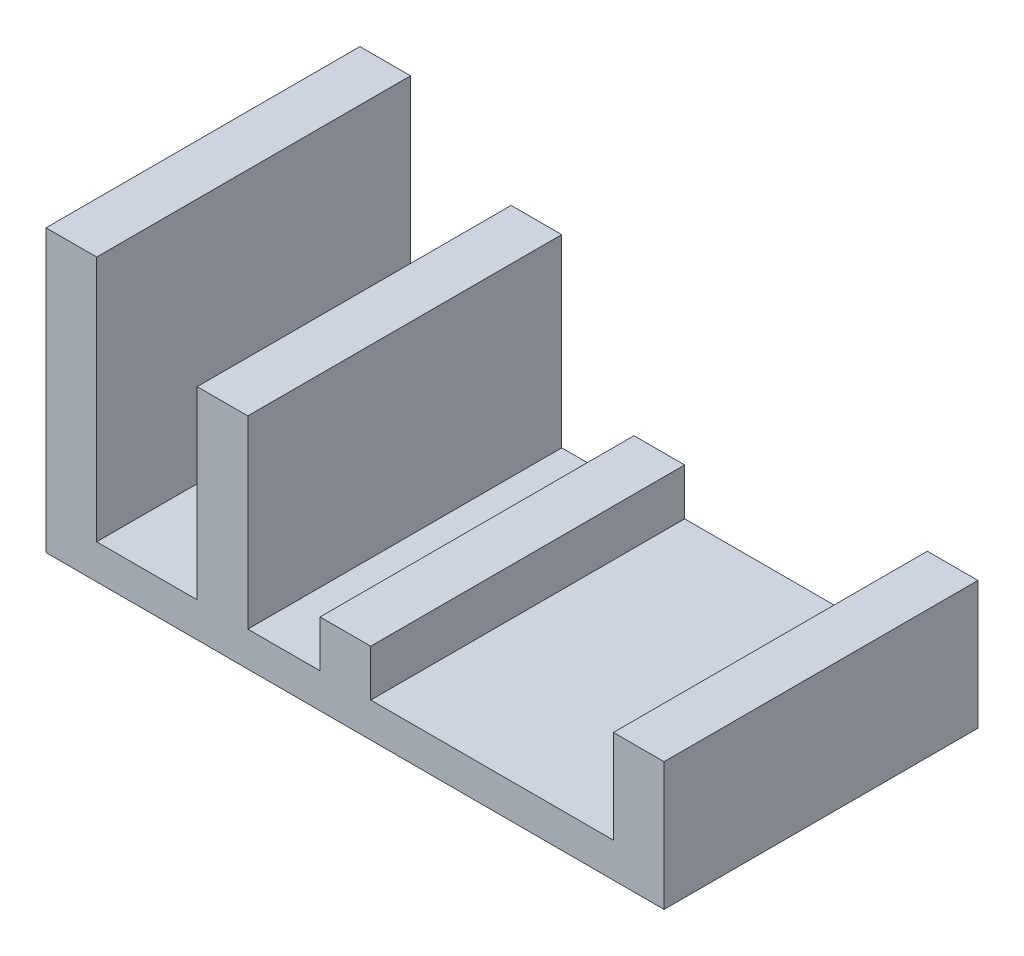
SolidWorks part; units mm, degrees
ref_plane "Front Plane" through (0, 0, 0) normal (0, 0, 1) x (1, 0, 0)
ref_plane "Top Plane" through (0, 0, 0) normal (0, 1, 0) x (1, 0, 0)
ref_plane "Right Plane" through (0, 0, 0) normal (1, 0, 0) x (0, 0, -1)
sketch "Sketch1" plane through (0, 0, 0) normal (0, 0, 1) x (1, 0, 0)
  line L0 (0, 67.4845) -> (0, 0)
  line L1 (0, 0) -> (148.2903, 0)
  line L2 (148.2903, 0) -> (148.2903, 30.7016)
  line L3 (148.2903, 30.7016) -> (136.1376, 30.7016)
  line L4 (136.1376, 30.7016) -> (136.1376, 8.315)
  line L5 (136.1376, 8.315) -> (77.9104, 8.315)
  line L6 (77.9104, 8.315) -> (77.9104, 19.5083)
  line L7 (77.9104, 19.5083) -> (65.7577, 19.5083)
  line L8 (65.7577, 19.5083) -> (65.7577, 8.315)
  line L9 (65.7577, 8.315) -> (48.4217, 8.315)
  line L10 (48.4217, 8.315) -> (48.4217, 52.6144)
  line L11 (48.4217, 52.6144) -> (36.269, 52.6144)
  line L12 (36.269, 52.6144) -> (36.269, 8.315)
  line L13 (36.269, 8.315) -> (12.1527, 8.315)
  line L14 (12.1527, 8.315) -> (12.1527, 67.4845)
  line L15 (12.1527, 67.4845) -> (0, 67.4845)
extrude "Extrude1" add sketch "Sketch1" along normal mid plane 75.319
sketch "Sketch2" plane through (148.2903, 0, 0) normal (1, 0, 0) x (0, 0, -1)
  circle A0 centre (0, 41.0398) radius 10.0121
